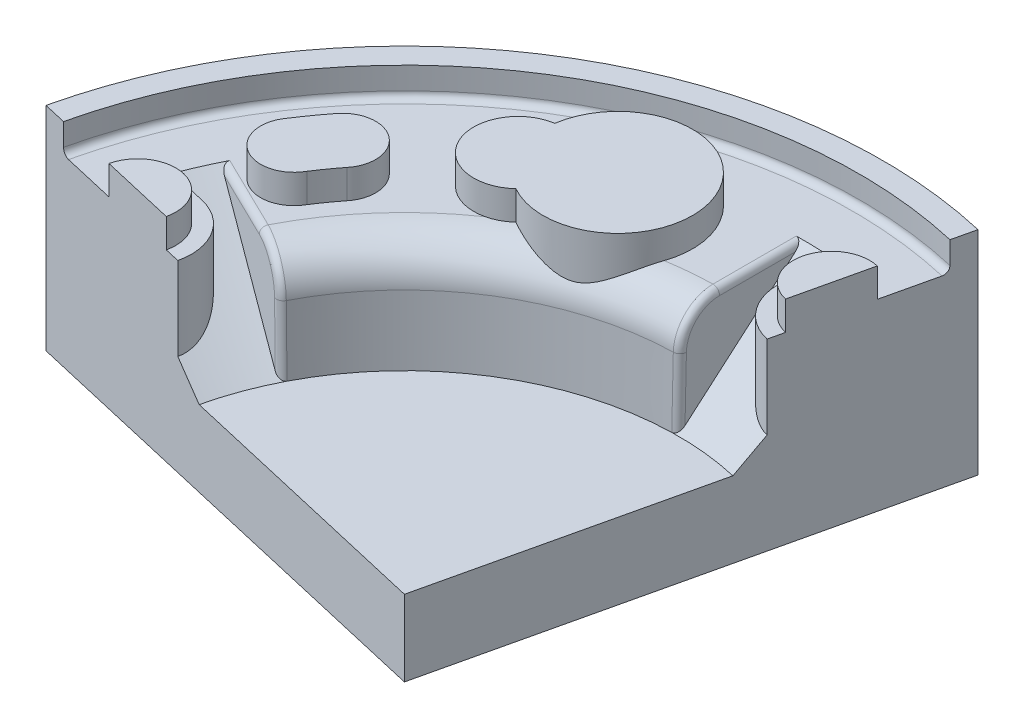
SolidWorks part; units mm, degrees
ref_plane "Front Plane" through (0, 0, 0) normal (0, 0, 1) x (1, 0, 0)
ref_plane "Top Plane" through (0, 0, 0) normal (0, 1, 0) x (1, 0, 0)
ref_plane "Right Plane" through (0, 0, 0) normal (1, 0, 0) x (0, 0, -1)
body saved out of another part "Insert Rework"
sketch "Contain" plane through (0, 0, 0) normal (0, -1, 0) x (1, 0, 0)
  line L0 (15.1706, 36.6753) -> (27.0144, 42.4519) construction
  line L1 (23.2871, 40.634) -> (27.7336, 42.8027)
  line L2 (57.15, 57.15) -> (25.2601, 49.7876)
  line L3 (64.5124, 25.2601) -> (57.15, 57.15)
  line L6 (57.15, 23.6211) -> (57.15, 10.4437) construction
  line L7 (57.15, 24.4213) -> (57.15, 19.4741)
  arc A0 (23.2871, 40.634) -> (57.15, 19.4741) centre (57.15, 57.15) ccw
  arc A4 (56.375, 24.4305) -> (64.5124, 25.2601) centre (57.15, 57.15) ccw
  arc A5 (28.0816, 42.1102) -> (56.375, 24.4305) centre (57.15, 57.15) ccw
  arc A6 (25.2601, 49.7876) -> (28.0816, 42.1102) centre (57.15, 57.15) ccw
  arc A7 (56.375, 24.4305) -> (57.15, 24.4213) centre (57.15, 57.15) ccw
  arc A8 (28.0816, 42.1102) -> (56.375, 24.4305) centre (57.15, 57.15) ccw
  arc A9 (27.7336, 42.8027) -> (28.0816, 42.1102) centre (57.15, 57.15) ccw
  dimension "D1" = 0
